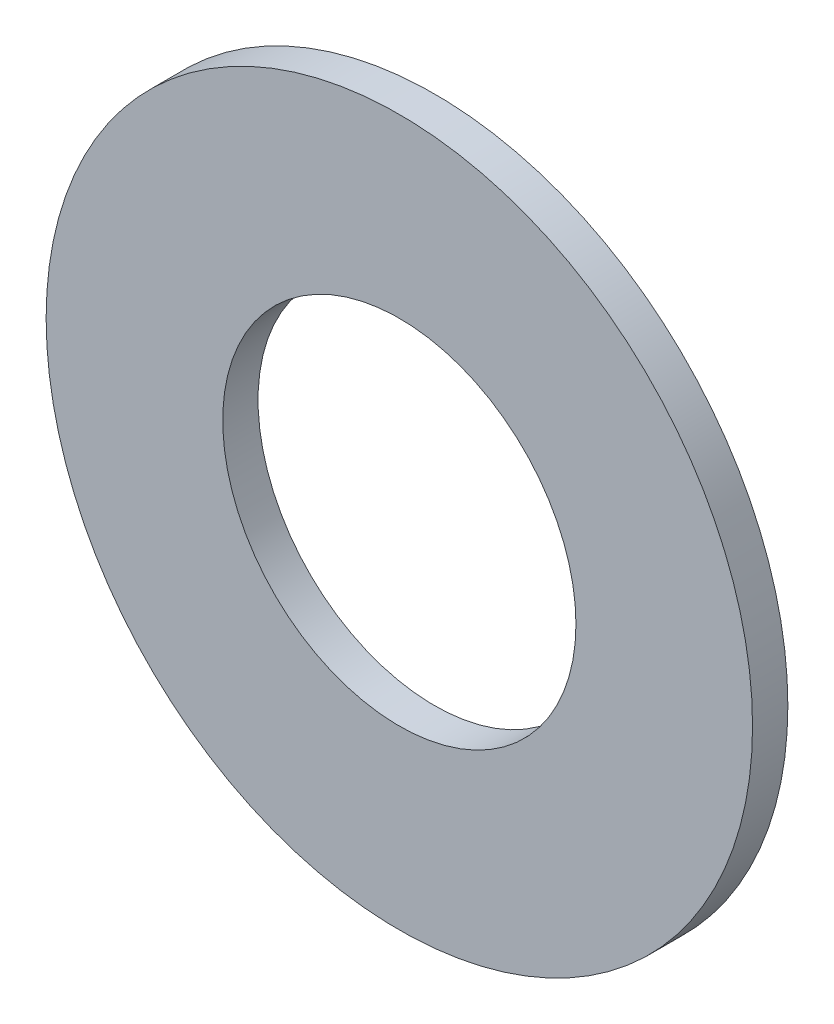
SolidWorks part; units mm, degrees
ref_plane "Face" through (0, 0, 0) normal (0, 0, 1) x (1, 0, 0)
ref_plane "Dessus" through (0, 0, 0) normal (0, 1, 0) x (1, 0, 0)
ref_plane "Droite" through (0, 0, 0) normal (1, 0, 0) x (0, 0, -1)
sketch "Esquisse1" plane through (0, 0, 0) normal (0, 0, 1) x (1, 0, 0)
  circle A0 centre (0, 0) radius 10
  circle A1 centre (0, 0) radius 5
  dimension "D1" = 20
  dimension "D2" = 10
extrude "Base-Extrusion" add sketch "Esquisse1" against normal blind 1
